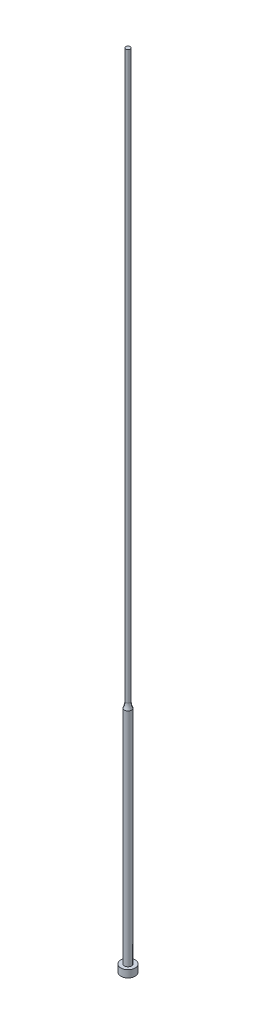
SolidWorks part; units mm, degrees
ref_plane "Front Plane" through (0, 0, 0) normal (0, 0, 1) x (1, 0, 0)
ref_plane "Top Plane" through (0, 0, 0) normal (0, 1, 0) x (1, 0, 0)
ref_plane "Right Plane" through (0, 0, 0) normal (1, 0, 0) x (0, 0, -1)
sketch "Sketch2" plane through (0, 0, 0) normal (0, 0, 1) x (1, 0, 0)
  line L0 (0, 0) -> (3.175, 0)
  line L1 (55, 0) -> (-55, 0) construction
  line L2 (3.175, 0) -> (3.175, 3.175)
  line L3 (3.175, 3.175) -> (1.5875, 3.175)
  line L4 (1.5875, 3.175) -> (1.5875, 101.6)
  line L5 (1.5875, 101.6) -> (0.9919, 101.6)
  line L6 (0.9919, 101.6) -> (0.9919, 355.6)
  line L7 (0.9919, 355.6) -> (0, 355.6)
  line L8 (0, 355.6) -> (0, 0)
  dimension "D1" = 3.175
  dimension "D2" = 3.175
  dimension "D3" = 1.5875
  dimension "D4" = 101.6
  dimension "D5" = 0.9919
  dimension "D6" = 355.6
revolve "Revolve1" add sketch "Sketch2" angle 360 about L8
fillet "Fillet1" radius 6.35 1 edges at (-0.9919, 101.6, 0)
